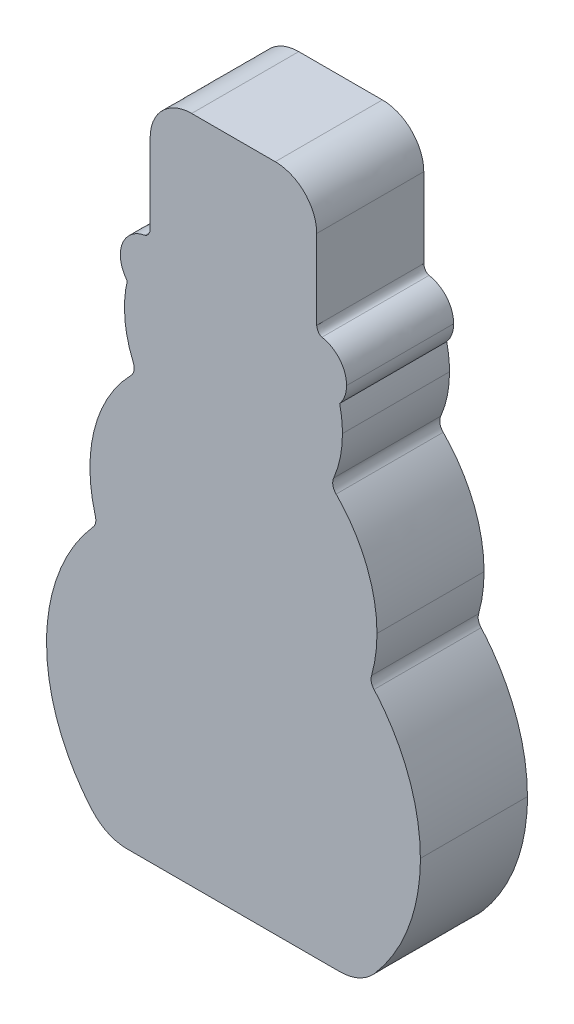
SolidWorks part; units mm, degrees
ref_plane "Front Plane" through (0, 0, 0) normal (0, 0, 1) x (1, 0, 0)
ref_plane "Top Plane" through (0, 0, 0) normal (0, 1, 0) x (1, 0, 0)
ref_plane "Right Plane" through (0, 0, 0) normal (1, 0, 0) x (0, 0, -1)
sketch "Sketch1" plane through (0, 0, 0) normal (0, 0, 1) x (1, 0, 0)
  spline S0 degree 3 poles (451.2755, 288.0078) (450.9533, 288.3912) (450.759, 288.8855) (450.759, 289.4242) knots 0 0 0 0 0.030303 0.030303 0.030303 0.030303
  spline S1 degree 3 poles (450.759, 289.4242) (450.7499, 290.5032) (451.5157, 291.4252) (452.5782, 291.6135) knots 0.060606 0.060606 0.060606 0.060606 0.090909 0.090909 0.090909 0.090909
  spline S2 degree 3 poles (452.5782, 291.6135) (452.8091, 291.6516) (452.9877, 291.9933) (452.9885, 292.2099) knots 0.090909 0.090909 0.090909 0.090909 0.121212 0.121212 0.121212 0.121212
  spline S3 degree 2 poles (452.9885, 292.2099) (452.9885, 292.2099) (452.9885, 298.1498) knots 0.121212 0.121212 0.121212 0.151515 0.151515 0.151515
  spline S4 degree 3 poles (452.9885, 298.1498) (452.9885, 299.857) (454.3781, 301.2465) (456.0853, 301.2465) knots 0.151515 0.151515 0.151515 0.151515 0.181818 0.181818 0.181818 0.181818
  spline S5 degree 2 poles (456.0853, 301.2465) (456.0853, 301.2465) (462.3315, 301.2465) knots 0.181818 0.181818 0.181818 0.212121 0.212121 0.212121
  spline S6 degree 3 poles (462.3315, 301.2465) (464.0385, 301.2465) (465.4284, 299.8568) (465.4284, 298.1498) knots 0.212121 0.212121 0.212121 0.212121 0.242424 0.242424 0.242424 0.242424
  spline S7 degree 2 poles (465.4284, 298.1498) (465.4284, 298.1498) (465.4284, 292.2099) knots 0.242424 0.242424 0.242424 0.272727 0.272727 0.272727
  spline S8 degree 3 poles (465.4284, 292.2099) (465.4284, 292.0019) (465.5989, 291.673) (465.8205, 291.6355) knots 0.272727 0.272727 0.272727 0.272727 0.30303 0.30303 0.30303 0.30303
  spline S9 degree 3 poles (465.8205, 291.6355) (466.8936, 291.445) (467.667, 290.5137) (467.6578, 289.4242) knots 0.30303 0.30303 0.30303 0.30303 0.333333 0.333333 0.333333 0.333333
  spline S10 degree 3 poles (467.6578, 289.4242) (467.6578, 288.8855) (467.4634, 288.3912) (467.1411, 288.0078) knots 0.363636 0.363636 0.363636 0.363636 0.393939 0.393939 0.393939 0.393939
  spline S11 degree 3 poles (467.1411, 288.0078) (467.2784, 287.4153) (467.3509, 286.798) (467.3509, 286.1638) knots 0.393939 0.393939 0.393939 0.393939 0.424242 0.424242 0.424242 0.424242
  spline S12 degree 3 poles (467.3509, 286.1638) (467.3509, 285.0647) (467.1313, 283.9801) (466.6996, 282.9692) knots 0.424242 0.424242 0.424242 0.424242 0.454545 0.454545 0.454545 0.454545
  spline S13 degree 3 poles (466.6996, 282.9692) (466.5541, 282.6283) (466.6194, 282.2791) (466.8785, 282.014) knots 0.454545 0.454545 0.454545 0.454545 0.484848 0.484848 0.484848 0.484848
  spline S14 degree 3 poles (466.8785, 282.014) (468.8413, 280.0051) (469.9315, 277.3301) (469.9315, 274.5211) knots 0.484848 0.484848 0.484848 0.484848 0.515152 0.515152 0.515152 0.515152
  spline S15 degree 3 poles (469.9315, 274.5211) (469.9315, 273.5345) (469.7972, 272.5524) (469.5289, 271.6029) knots 0.515152 0.515152 0.515152 0.515152 0.545455 0.545455 0.545455 0.545455
  spline S16 degree 3 poles (469.5289, 271.6029) (469.4423, 271.2965) (469.5032, 271.0277) (469.713, 270.7883) knots 0.545455 0.545455 0.545455 0.545455 0.575758 0.575758 0.575758 0.575758
  spline S17 degree 3 poles (469.713, 270.7883) (471.9509, 268.2352) (473.1727, 264.9837) (473.1727, 261.5884) knots 0.575758 0.575758 0.575758 0.575758 0.606061 0.606061 0.606061 0.606061
  spline S18 degree 3 poles (473.1727, 261.5884) (473.1727, 258.2242) (471.9733, 255.0004) (469.7721, 252.4564) knots 0.606061 0.606061 0.606061 0.606061 0.636364 0.636364 0.636364 0.636364
  spline S19 degree 3 poles (469.7721, 252.4564) (469.0923, 251.6708) (468.1639, 251.2465) (467.1251, 251.2465) knots 0.636364 0.636364 0.636364 0.636364 0.666667 0.666667 0.666667 0.666667
  spline S20 degree 2 poles (467.1251, 251.2465) (467.1251, 251.2465) (451.2917, 251.2465) knots 0.666667 0.666667 0.666667 0.69697 0.69697 0.69697
  spline S21 degree 3 poles (451.2917, 251.2465) (450.2529, 251.2465) (449.3245, 251.6708) (448.6447, 252.4564) knots 0.69697 0.69697 0.69697 0.69697 0.727273 0.727273 0.727273 0.727273
  spline S22 degree 3 poles (448.6447, 252.4564) (446.4435, 255.0004) (445.2441, 258.2242) (445.2441, 261.5884) knots 0.727273 0.727273 0.727273 0.727273 0.757576 0.757576 0.757576 0.757576
  spline S23 degree 3 poles (445.2441, 261.5884) (445.2441, 264.9837) (446.4658, 268.235) (448.7036, 270.7882) knots 0.757576 0.757576 0.757576 0.757576 0.787879 0.787879 0.787879 0.787879
  spline S24 degree 3 poles (448.7036, 270.7882) (448.9134, 271.0275) (448.9742, 271.2964) (448.8877, 271.6026) knots 0.787879 0.787879 0.787879 0.787879 0.818182 0.818182 0.818182 0.818182
  spline S25 degree 3 poles (448.8877, 271.6026) (448.6195, 272.5523) (448.4851, 273.5344) (448.4851, 274.5211) knots 0.818182 0.818182 0.818182 0.818182 0.848485 0.848485 0.848485 0.848485
  spline S26 degree 3 poles (448.4851, 274.5211) (448.4851, 277.3301) (449.5753, 280.0051) (451.5381, 282.014) knots 0.848485 0.848485 0.848485 0.848485 0.878788 0.878788 0.878788 0.878788
  spline S27 degree 3 poles (451.5381, 282.014) (451.7972, 282.2791) (451.8625, 282.6283) (451.7169, 282.9692) knots 0.878788 0.878788 0.878788 0.878788 0.909091 0.909091 0.909091 0.909091
  spline S28 degree 3 poles (451.7169, 282.9692) (451.2853, 283.9801) (451.0657, 285.0647) (451.0657, 286.1638) knots 0.909091 0.909091 0.909091 0.909091 0.939394 0.939394 0.939394 0.939394
  spline S29 degree 3 poles (451.0657, 286.1638) (451.0657, 286.798) (451.1382, 287.4153) (451.2755, 288.0078) knots 0.939394 0.939394 0.939394 0.939394 1 1 1 1
extrude "Boss-Extrude1" add sketch "Sketch1" along normal blind 8
